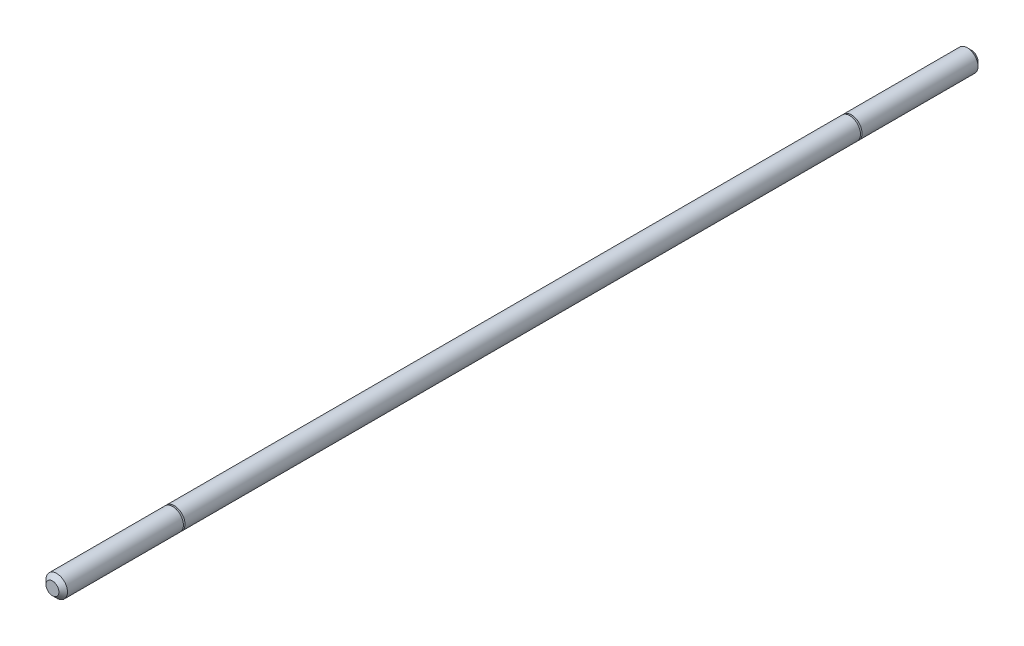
SolidWorks part; units mm, degrees
ref_plane "Front Plane" through (0, 0, 0) normal (0, 0, 1) x (1, 0, 0)
ref_plane "Top Plane" through (0, 0, 0) normal (0, 1, 0) x (1, 0, 0)
ref_plane "Right Plane" through (0, 0, 0) normal (1, 0, 0) x (0, 0, -1)
sketch "Sketch1" plane through (0, 0, 0) normal (0, 0, 1) x (1, 0, 0)
  circle A0 centre (0, 0) radius 7.9375
  dimension "D1" = 15.875
extrude "Extrude1" add sketch "Sketch1" along normal mid plane 679.45
chamfer "Chamfer1" distance 3.175 angle 45 2 edges at (7.9375, 0, -339.725) (7.9375, 0, 339.725)
ref_plane "Plane1" through (0, 0, 250.825) normal (0, 0, 1) x (1, 0, 0)
sketch "Sketch4" plane through (0, 0, 250.825) normal (0, 0, 1) x (1, 0, 0)
  circle A0 centre (0, 0) radius 6.1595
  dimension "D1" = 12.319
extrude "Retaining Ring Groove" cut sketch "Sketch4" against normal blind 1.1684 flip side to cut
mirror "Mirror1" about plane through (0, 0, 0) normal (0, 0, 1) of "Retaining Ring Groove"
